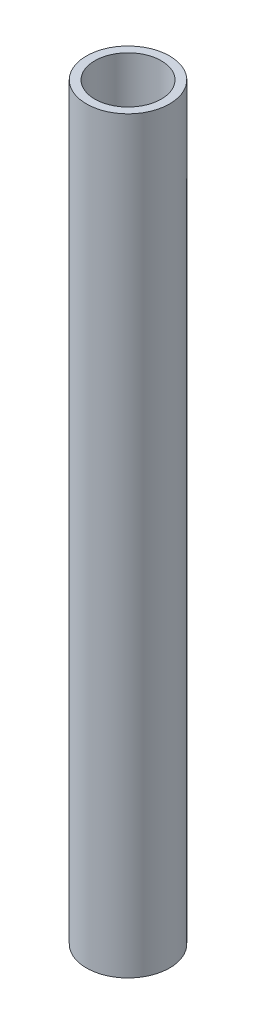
SolidWorks part; units mm, degrees
ref_plane "Front Plane" through (0, 0, 0) normal (0, 0, 1) x (1, 0, 0)
ref_plane "Top Plane" through (0, 0, 0) normal (0, 1, 0) x (1, 0, 0)
ref_plane "Right Plane" through (0, 0, 0) normal (1, 0, 0) x (0, 0, -1)
sketch "Sketch1" plane through (0, 0, 0) normal (0, 1, 0) x (1, 0, 0)
  circle A0 centre (0, 0) radius 10
  dimension "D1" = 20
extrude "Boss-Extrude1" add sketch "Sketch1" along normal blind 180
sketch "Sketch3" plane through (0, 180, 0) normal (0, 1, 0) x (1, 0, 0)
  circle A0 centre (0, 0) radius 8
  circle A1 centre (0, 0) radius 10 construction
  dimension "D1" = 2
extrude "Cut-Extrude1" cut sketch "Sketch3" against normal blind 180
